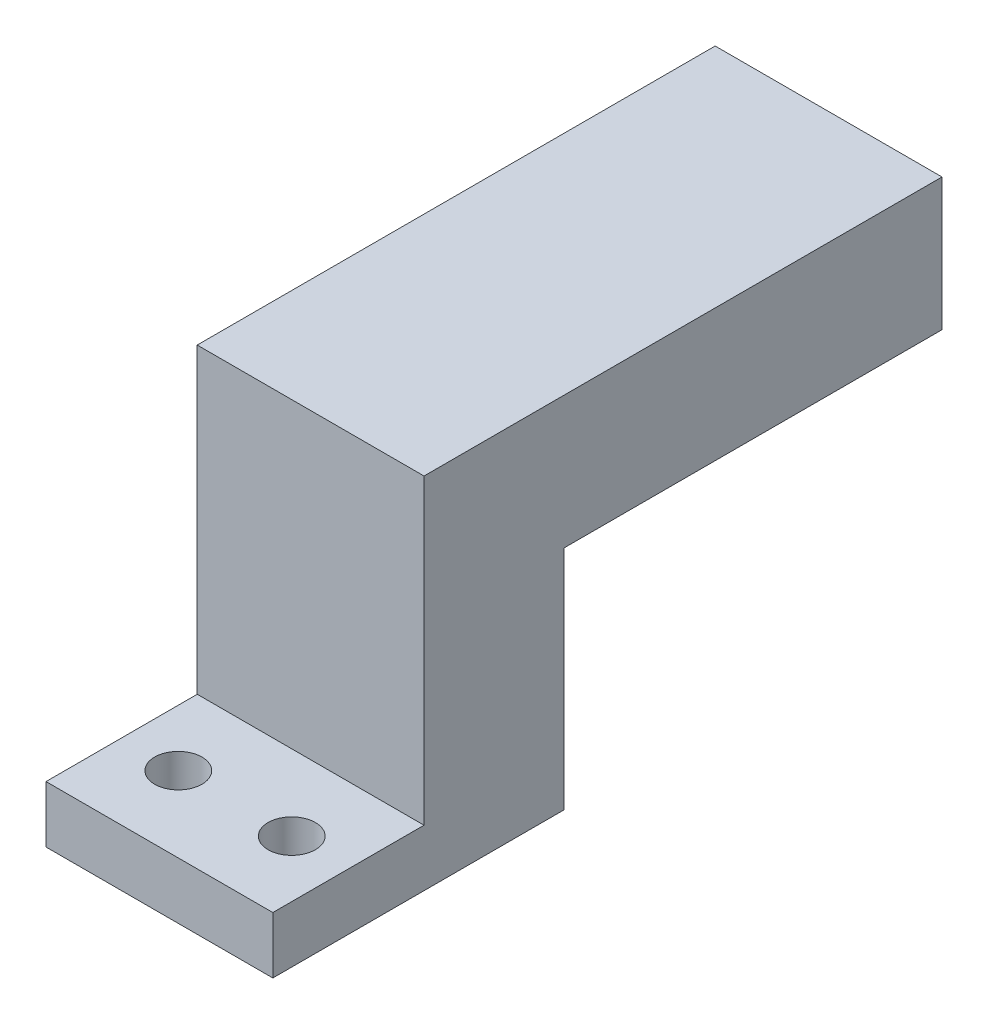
SolidWorks part; units mm, degrees
ref_plane "Спереди" through (0, 0, 0) normal (0, 0, 1) x (1, 0, 0)
ref_plane "Сверху" through (0, 0, 0) normal (0, 1, 0) x (1, 0, 0)
ref_plane "Справа" through (0, 0, 0) normal (1, 0, 0) x (0, 0, -1)
sketch "Sketch1" plane through (0, 0, 0) normal (1, 0, 0) x (0, 0, -1)
  line L0 (0, 0) -> (15.4021, 0)
  line L1 (15.4021, 0) -> (15.4021, 12)
  line L2 (15.4021, 12) -> (35.4021, 12)
  line L3 (35.4021, 12) -> (35.4021, 19)
  line L4 (35.4021, 19) -> (8, 19)
  line L5 (8, 19) -> (8, 3)
  line L6 (8, 3) -> (0, 3)
  line L7 (0, 3) -> (0, 0)
  dimension "D1" = 15.4021
  dimension "D2" = 3
  dimension "D3" = 16
  dimension "D4" = 20
  dimension "D5" = 8
  dimension "D6" = 12
extrude "Boss-Extrude1" add sketch "Sketch1" along normal blind 12
sketch "Sketch2" plane through (0, 3, 0) normal (0, 1, 0) x (1, 0, 0)
  line L0 (12, 0) -> (0, 0) construction
  line L1 (0, 8) -> (0, 0) construction
  line L2 (12, 8) -> (12, 0) construction
  circle A0 centre (3, 4) radius 1.25
  circle A1 centre (9, 4) radius 1.25
  dimension "D5" = 2.5
  dimension "D6" = 2.5
  dimension "D1" = 4
  dimension "D2" = 4
  dimension "D3" = 3
  dimension "D4" = 3
extrude "Cut-Extrude1" cut sketch "Sketch2" against normal blind 12
sketch "Sketch4" plane through (12, 0, 0) normal (1, 0, 0) x (0, 0, -1)
  line L0 (8, 19) -> (0, 3)
  line L1 (0, 3) -> (8, 3)
  line L2 (8, 3) -> (8, 19)
